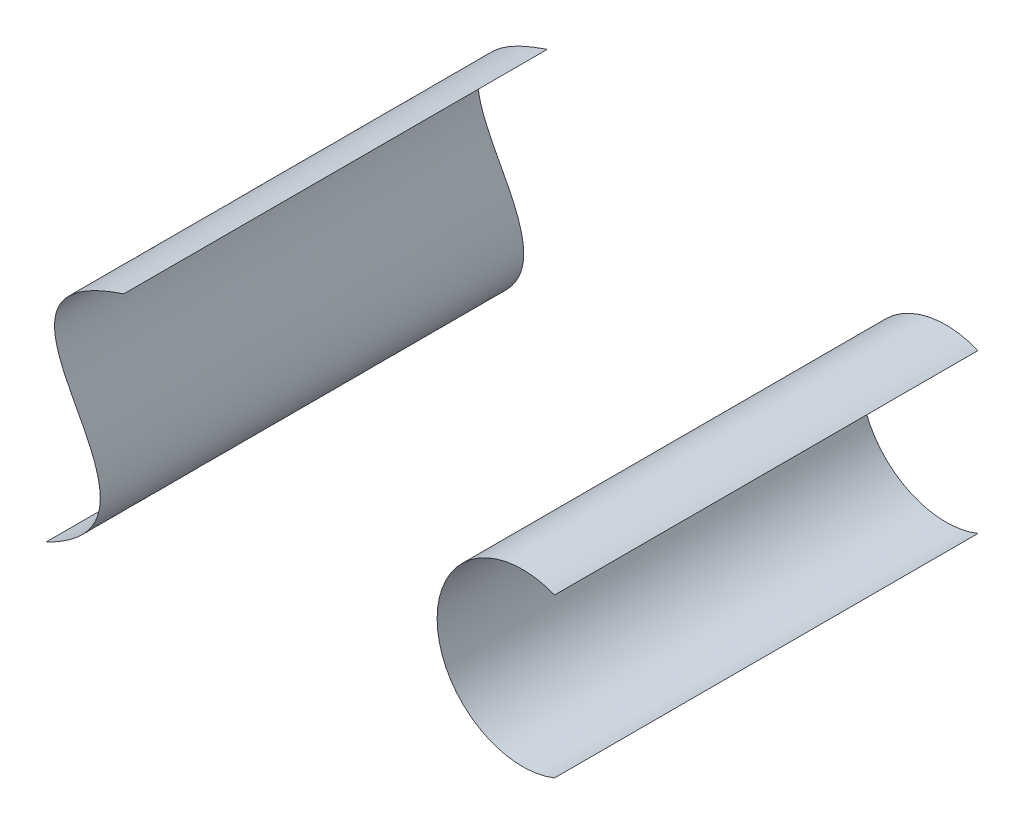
SolidWorks part; units mm, degrees
ref_plane "Front Plane" through (0, 0, 0) normal (0, 0, 1) x (1, 0, 0)
ref_plane "Top Plane" through (0, 0, 0) normal (0, 1, 0) x (1, 0, 0)
ref_plane "Right Plane" through (0, 0, 0) normal (1, 0, 0) x (0, 0, -1)
sketch "Sketch1" plane through (0, 0, 0) normal (0, 0, 1) x (1, 0, 0)
  arc A0 (130.3515, 70.5848) -> (130.3515, 14.4714) centre (119.0049, 42.5281) ccw
  spline S1 degree 3 poles (-22.2359, 86.694) (-88.8959, 64.7145) (7.7806, 25.082) (-49.806, -3.2479) knots 0 0 0 0 1 1 1 1
surface "Surface-Extrude1" sketch "Sketch1" parameters "D1"=150
sketch "Sketch3" plane through (0, 0, 0) normal (1, 0, 0) x (0, 0, -1)
  line L0 (0, 78.9894) -> (0, 26.3086) construction
  point P3 (0, 26.3086)
  point P6 (0, 78.9894)
sketch3d "3DSketch2"
  spline S2 degree 3 poles (277.9491, 53.123, 139.4588) (259.274, -28.8542, 157.6674) (306.7188, 66.4782, -22.1006) (240.8496, 51.4467, 107.0541) (226.1945, 56.4226, -1.8804) (261.2349, 55.2131, 6.0558) knots 0 0 0 0 0.519139 0.67935 1 1 1 1
sketch "Sketch4" plane through (0, 0, 0) normal (1, 0, 0) x (0, 0, -1)
  spline S0 degree 3 poles (-127.9964, 20.031) (-112.6026, 112.4899) (-53.6672, 16.9102) (-17.0483, 69.2012) knots 0 0 0 0 1 1 1 1
curve "Curve1"
ref_plane "Plane8" through (-30.7458, 22.5868, 0) normal (-0.9928, -0.1202, 0) x (0, 0, 1)
ref_plane "Plane9" through (-31.4626, 26.3086, 0) normal (-0.968, -0.2508, 0) x (0, 0, 1)
